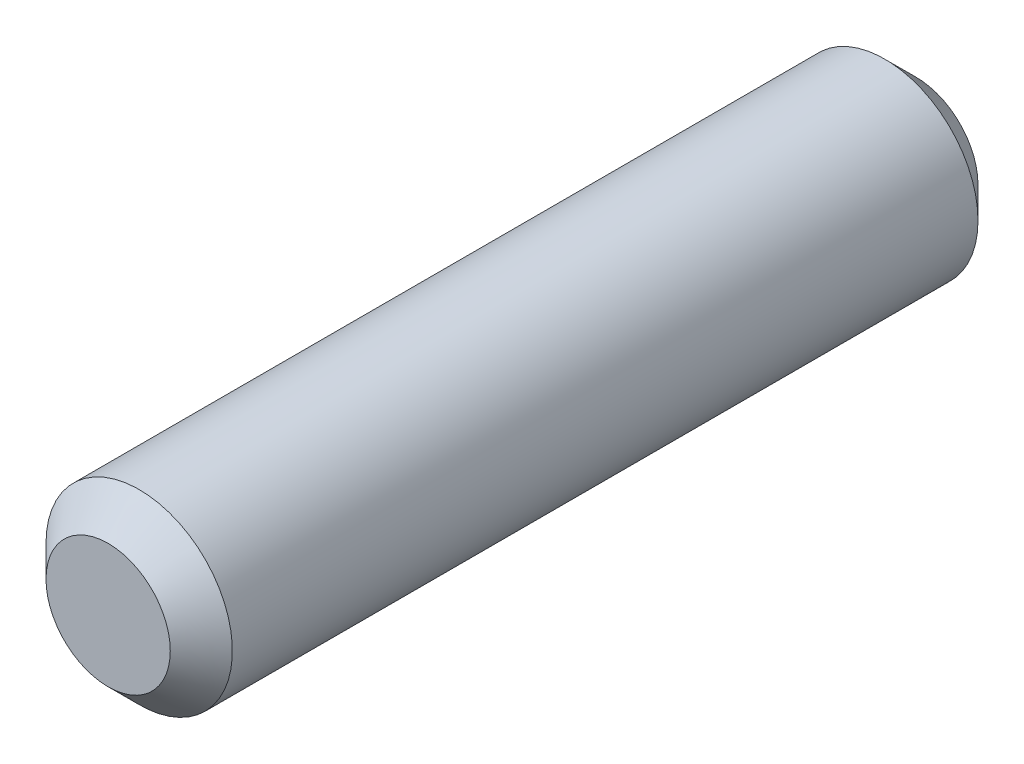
SolidWorks part; units mm, degrees
ref_plane "Face" through (0, 0, 0) normal (0, 0, 1) x (1, 0, 0)
ref_plane "Dessus" through (0, 0, 0) normal (0, 1, 0) x (1, 0, 0)
ref_plane "Droite" through (0, 0, 0) normal (1, 0, 0) x (0, 0, -1)
sketch "Esquisse1" plane through (0, 0, 0) normal (0, 0, 1) x (1, 0, 0)
  circle A0 centre (0, 0) radius 1.5
  dimension "D1" = 3
extrude "Cylindre de base" add sketch "Esquisse1" along normal mid plane 13
chamfer "Chanfrein1" distance 0.5 angle 45
